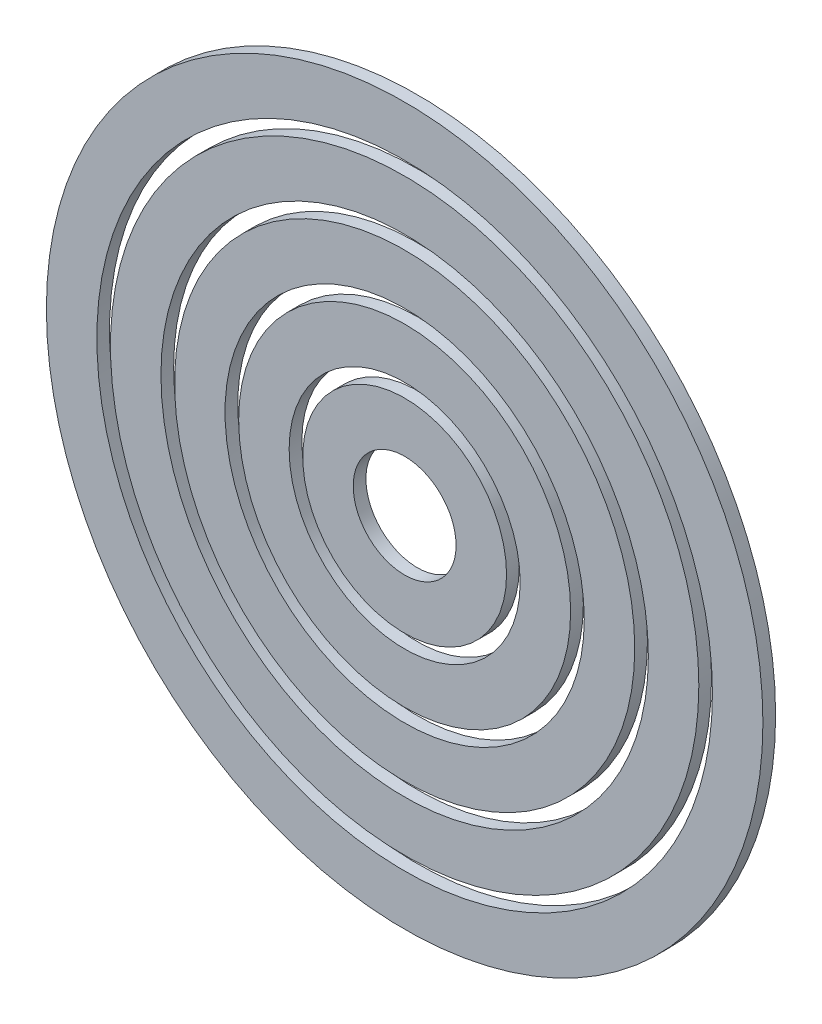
SolidWorks part; units mm, degrees
ref_plane "Front Plane" through (0, 0, 0) normal (0, 0, 1) x (1, 0, 0)
ref_plane "Top Plane" through (0, 0, 0) normal (0, 1, 0) x (1, 0, 0)
ref_plane "Right Plane" through (0, 0, 0) normal (1, 0, 0) x (0, 0, -1)
sketch "Sketch1" plane through (0, 0, 0) normal (0, 0, 1) x (1, 0, 0)
  circle A0 centre (0, 0) radius 15.9
  circle A1 centre (0, 0) radius 8.026
  circle A3 centre (0, 0) radius 25.9
  circle A4 centre (0, 0) radius 35.9
  circle A5 centre (0, 0) radius 45.9
  circle A6 centre (0, 0) radius 55.9
  circle A7 centre (0, 0) radius 48.026
  circle A8 centre (0, 0) radius 38.026
  circle A9 centre (0, 0) radius 28.026
  circle A10 centre (0, 0) radius 18.026
  dimension "D1" = 31.8
  dimension "D3" = 51.8
  dimension "D2" = 7.874
  dimension "D4" = 10
  dimension "D5" = 10
  dimension "D6" = 10
  dimension "D7" = 7.874
extrude "Boss-Extrude1" add sketch "Sketch1" along normal blind 1.9812 contours A6 A7 | A5 A8 | A4 A9 | A3 A10 | A0 A1
